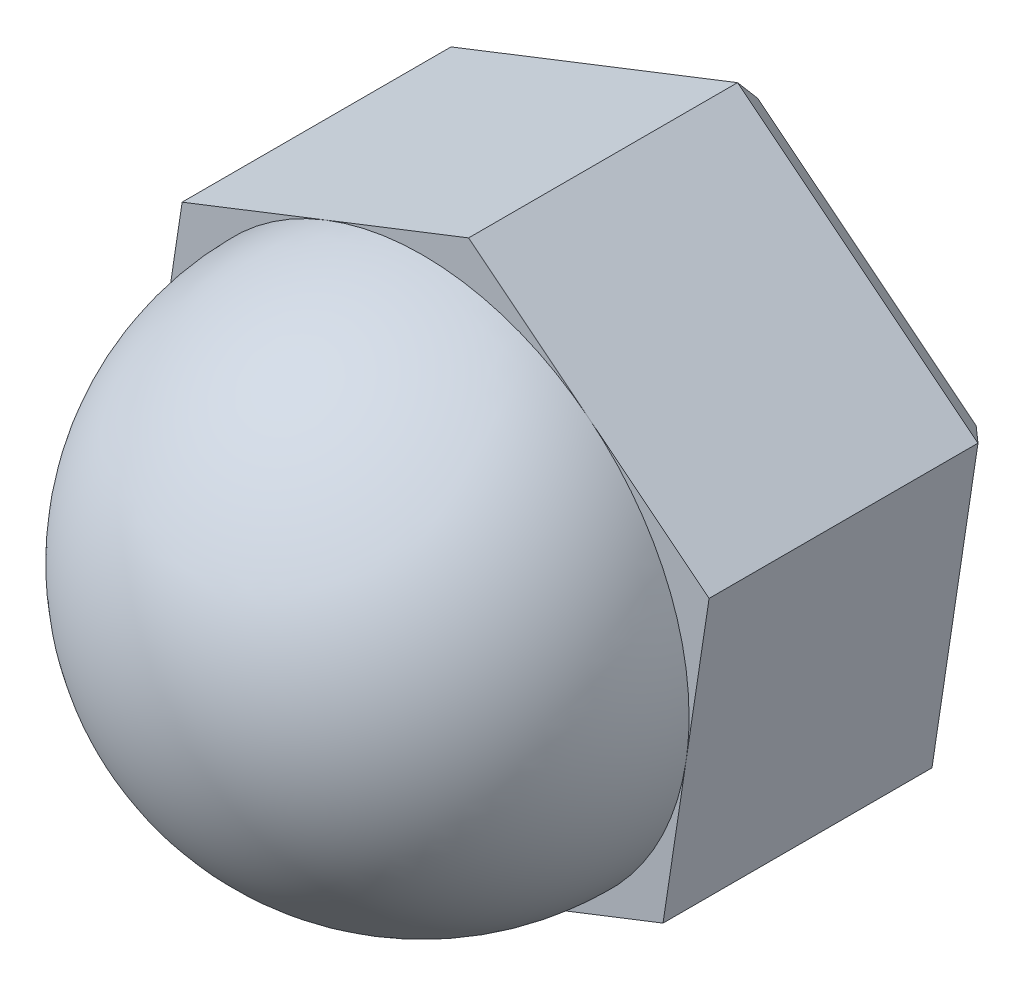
SolidWorks part; units mm, degrees
ref_plane "Plan de face" through (0, 0, 0) normal (0, 0, 1) x (1, 0, 0)
ref_plane "Plan de dessus" through (0, 0, 0) normal (0, 1, 0) x (1, 0, 0)
ref_plane "Plan de droite" through (0, 0, 0) normal (1, 0, 0) x (0, 0, -1)
sketch "Esquisse1" plane through (0, 0, 0) normal (0, 0, 1) x (1, 0, 0)
  line L1 (-2.459, 1.9632) -> (-2.9297, -1.148)
  line L2 (-2.9297, -1.148) -> (-0.4707, -3.1112)
  line L3 (-0.4707, -3.1112) -> (2.459, -1.9632)
  line L4 (2.459, -1.9632) -> (2.9297, 1.148)
  line L5 (2.9297, 1.148) -> (0.4707, 3.1112)
  line L6 (0.4707, 3.1112) -> (-2.459, 1.9632)
  circle A0 centre (0, 0) radius 2.725 construction
  dimension "D1" = 5.45
extrude "Boss.-Extru.1" add sketch "Esquisse1" along normal blind 3
sketch "Esquisse2" plane through (0, 0, 3) normal (0, 0, 1) x (1, 0, 0)
  circle A0 centre (0, 0) radius 2.725
extrude "Boss.-Extru.2" add sketch "Esquisse2" along normal blind 2.725
fillet "Congé1" radius 2.725 1 edges at (2.725, 0, 5.725)
sketch "Esquisse3" plane through (0, 0, 0) normal (0, 0, -1) x (-1, 0, 0)
  circle A0 centre (0, 0) radius 1.5
extrude "Enlèv. mat.-Extru.1" cut sketch "Esquisse3" against normal blind 4.5
chamfer "Chanfrein1" distance 0.25 angle 45 7 edges at (-2.6943, 0.4076, 0) (-1.7002, -2.1296, 0) (0.9942, -2.5372, 0) (2.6943, -0.4076, 0) (1.7002, 2.1296, 0) (-0.9942, 2.5372, 0) (-1.5, 0, 0)
